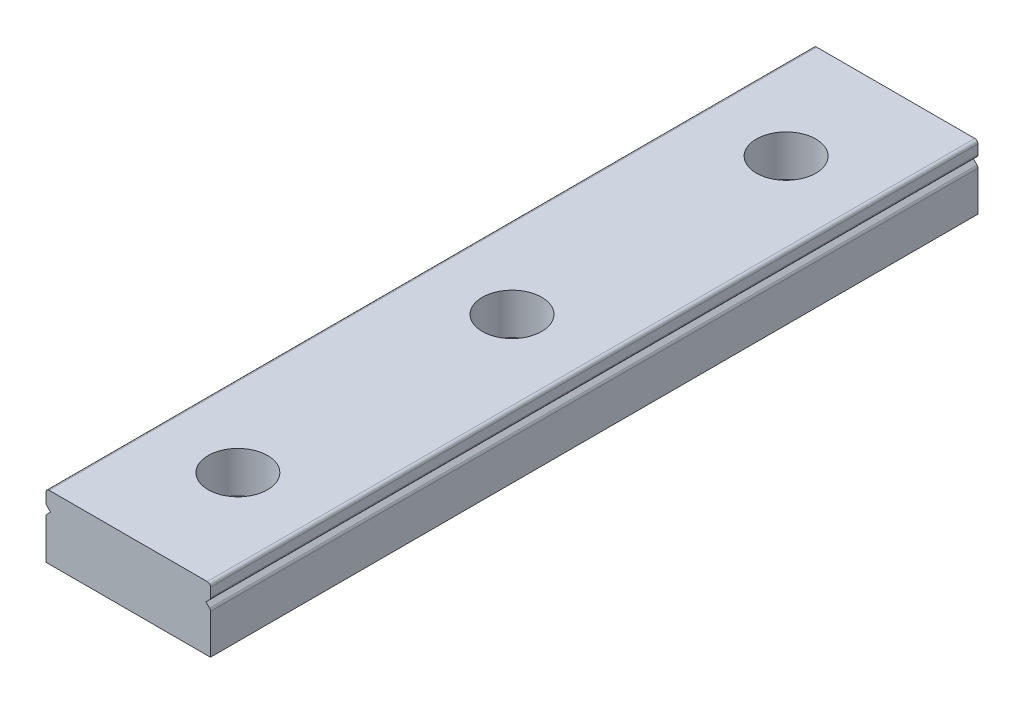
SolidWorks part; units mm, degrees
ref_plane "Front" through (0, 0, 0) normal (0, 0, 1) x (1, 0, 0)
ref_plane "Top" through (0, 0, 0) normal (0, 1, 0) x (1, 0, 0)
ref_plane "Right" through (0, 0, 0) normal (1, 0, 0) x (0, 0, -1)
sketch "Sketch2" plane through (0, 0, 0) normal (0, 0, 1) x (1, 0, 0)
  line L0 (8.5, 5) -> (9, 4.5)
  line L1 (0, 7) -> (9, 7)
  line L2 (0, 7) -> (0, 0)
  line L3 (0, 0) -> (9, 0)
  line L4 (9, 0) -> (9, 4.5)
  line L5 (9, 7) -> (9, 5.5)
  line L6 (9, 5.5) -> (8.5, 5)
  dimension "D1" = 7
  dimension "D2" = 9
  dimension "D3" = 1
  dimension "D4" = 1.5
extrude "Extrude3" add sketch "Sketch2" along normal blind 84
fillet "Fillet1" radius 0.35 3 edges at (9, 7, 42) (9, 5.5, 42) (9, 4.5, 42)
mirror "Mirror1" about plane through (0, 0, 0) normal (1, 0, 0) of "Fillet1", "Extrude3"
hole_wizard "CBORE for M3 SBHCS1" positions "Sketch4" profile "Sketch3" counterbore size "M3" standard "Ansi Metric"
sketch "Sketch4" plane through (0, 7, 0) normal (0, 1, 0) x (-1, 0, 0)
  point P0 (0, 12)
  dimension "D1" = 12
sketch "Sketch3" plane through (0, 7, 12) normal (1, 0, 0) x (0, 0, 1)
  line L0 (0, 0) -> (0, 7)
  line L1 (0, 7) -> (1.75, 7)
  line L3 (1.75, 7) -> (1.75, 4.5)
  line L4 (1.75, 4.5) -> (3.25, 4.5)
  line L5 (3.25, 4.5) -> (3.25, 0)
  line L7 (3.25, 0) -> (0, 0)
  line L11 (0, -6.35) -> (0, 107.95) construction
  dimension "Thru Hole Dia." = 3.5
  dimension "Thru Hole Depth" = 7
  dimension "C'Bore Dia." = 6.5
  dimension "C'Bore Depth" = 4.5
pattern_linear "LPattern3" count 3 spacing 30 along (0, 0, 1) of "CBORE for M3 SBHCS1"
